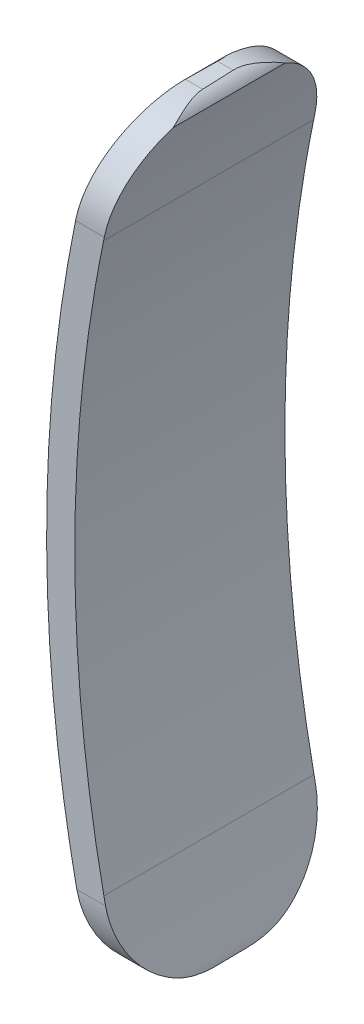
SolidWorks part; units mm, degrees
ref_plane "Front Plane" through (0, 0, 0) normal (0, 0, 1) x (1, 0, 0)
ref_plane "Top Plane" through (0, 0, 0) normal (0, 1, 0) x (1, 0, 0)
ref_plane "Right Plane" through (0, 0, 0) normal (1, 0, 0) x (0, 0, -1)
sketch "Sketch1" plane through (0, 0, 0) normal (0, 0, 1) x (1, 0, 0)
  arc A0 (-4.0644, 107.1781) -> (-0.2814, 105.8785) centre (-2.8226, 104.6368) cw
  arc A1 (-4, 0) -> (0, 0) centre (-2, 2) ccw
  ellipse E0 centre (191.9728, 53.8699) end of major axis (-11.2272, 53.8699) minor radius 203.1832 (-7.0515, 94.8489) -> (-7.0104, 12.6918) ccw
  spline S0 degree 3 poles (-7.0515, 94.8489) (-6.8815, 95.6746) (-6.7091, 96.4845) (-6.4476, 97.6768) (-6.36, 98.0705) (-6.1839, 98.85) (-6.0951, 99.2373) (-5.8335, 100.3632) (-5.6635, 101.0738) (-5.4171, 102.0805) (-5.3363, 102.4068) (-5.1785, 103.0364) (-5.1026, 103.3356) (-4.8841, 104.1886) (-4.7507, 104.6977) (-4.5716, 105.3701) (-4.5153, 105.5793) (-4.4127, 105.9574) (-4.3194, 106.2979) (-4.245, 106.5645) (-4.1804, 106.7937) (-4.153, 106.8898) (-4.0867, 107.118) (-4.0644, 107.1889) (-4.0644, 107.1781) knots 0 0 0 0 0.125 0.125 0.1875 0.1875 0.25 0.25 0.375 0.375 0.4375 0.4375 0.5 0.5 0.625 0.625 0.6875 0.6875 0.75 0.8125 0.8125 0.875 0.875 1 1 1 1
  spline S1 degree 3 poles (-4, 0) (-4, 0.0108) (-4.0229, 0.1047) (-4.0894, 0.3644) (-4.117, 0.4709) (-4.183, 0.7246) (-4.2215, 0.8721) (-4.3501, 1.3655) (-4.454, 1.7644) (-4.6346, 2.466) (-4.6994, 2.7187) (-4.8347, 3.251) (-4.9054, 3.5304) (-5.1252, 4.4073) (-5.2823, 5.0433) (-5.6153, 6.4214) (-5.7865, 7.1444) (-6.0471, 8.2727) (-6.1347, 8.6565) (-6.3111, 9.4398) (-6.4004, 9.8412) (-6.6655, 11.0503) (-6.8395, 11.8661) (-7.0104, 12.6918) knots 0 0 0 0 0.125 0.125 0.1875 0.1875 0.25 0.25 0.375 0.375 0.4375 0.4375 0.5 0.5 0.625 0.625 0.75 0.75 0.8125 0.8125 0.875 0.875 1 1 1 1
  spline S2 degree 3 poles (-0.2814, 105.8785) (-0.3009, 105.8117) (-0.3322, 105.7026) (-0.4494, 105.2861) (-0.6483, 104.5609) (-0.9701, 103.3501) (-1.4784, 101.3687) (-2.0763, 98.8983) (-2.6876, 96.1673) (-2.9886, 94.7467) (-3.1337, 94.0421) knots 0 0 0 0 0.055316 0.110633 0.221265 0.331898 0.44253 0.663795 0.774428 0.885061 0.885061 0.885061 0.885061
  spline S3 degree 3 poles (-3.1337, 94.0421) (-4.4963, 87.4256) (-6.549, 74.044) (-7.5713, 53.7701) (-6.5287, 33.4972) (-4.4626, 20.1176) (-3.0934, 13.5025) knots -0.203078 -0.203078 -0.203078 -0.203078 -0.101289 0.000501 0.10229 0.204079 0.204079 0.204079 0.204079
  spline S4 degree 3 poles (-3.0934, 13.5025) (-2.9275, 12.701) (-2.5823, 11.0819) (-2.0603, 8.7674) (-1.5539, 6.6297) (-1.0883, 4.7446) (-0.7522, 3.427) (-0.5305, 2.5706) (-0.3895, 2.0293) (-0.2931, 1.6598) (-0.2309, 1.4203) (-0.1914, 1.267) (-0.1636, 1.158) (-0.1438, 1.0788) (-0.1296, 1.0209) (-0.1149, 0.9593) (-0.1004, 0.8964) (-0.0837, 0.8182) (-0.0693, 0.7456) (-0.0527, 0.6503) (-0.0368, 0.548) (-0.0194, 0.4041) (-0.0052, 0.2314) (0, 0.071) (0, 0) knots 0 0 0 0 0.125 0.25 0.375 0.5 0.625 0.6875 0.75 0.8125 0.84375 0.875 0.90625 0.921875 0.9375 0.953125 0.96875 0.976562 0.984375 0.988281 0.992188 0.996094 0.998047 1 1 1 1
sketch "Sketch2" plane through (0, 0, 0) normal (0, 0, 1) x (1, 0, 0)
  arc A0 (-4.0644, 107.1781) -> (-0.2814, 105.8785) centre (-2.8226, 104.6368) cw
  arc A1 (-4, 0) -> (0, 0) centre (-2, 2) ccw
  ellipse E0 centre (191.9728, 53.8699) end of major axis (-11.2272, 53.8699) minor radius 203.1832 (-7.0515, 94.8489) -> (-7.0104, 12.6918) ccw
  spline S0 degree 3 poles (-7.0515, 94.8489) (-6.8815, 95.6746) (-6.7091, 96.4845) (-6.4476, 97.6768) (-6.36, 98.0705) (-6.1839, 98.85) (-6.0951, 99.2373) (-5.8335, 100.3632) (-5.6635, 101.0738) (-5.4171, 102.0805) (-5.3363, 102.4068) (-5.1785, 103.0364) (-5.1026, 103.3356) (-4.8841, 104.1886) (-4.7507, 104.6977) (-4.5716, 105.3701) (-4.5153, 105.5793) (-4.4127, 105.9574) (-4.3194, 106.2979) (-4.245, 106.5645) (-4.1804, 106.7937) (-4.153, 106.8898) (-4.0867, 107.118) (-4.0644, 107.1889) (-4.0644, 107.1781) knots 0 0 0 0 0.125 0.125 0.1875 0.1875 0.25 0.25 0.375 0.375 0.4375 0.4375 0.5 0.5 0.625 0.625 0.6875 0.6875 0.75 0.8125 0.8125 0.875 0.875 1 1 1 1
  spline S1 degree 3 poles (-4, 0) (-4, 0.0108) (-4.0229, 0.1047) (-4.0894, 0.3644) (-4.117, 0.4709) (-4.183, 0.7246) (-4.2215, 0.8721) (-4.3501, 1.3655) (-4.454, 1.7644) (-4.6346, 2.466) (-4.6994, 2.7187) (-4.8347, 3.251) (-4.9054, 3.5304) (-5.1252, 4.4073) (-5.2823, 5.0433) (-5.6153, 6.4214) (-5.7865, 7.1444) (-6.0471, 8.2727) (-6.1347, 8.6565) (-6.3111, 9.4398) (-6.4004, 9.8412) (-6.6655, 11.0503) (-6.8395, 11.8661) (-7.0104, 12.6918) knots 0 0 0 0 0.125 0.125 0.1875 0.1875 0.25 0.25 0.375 0.375 0.4375 0.4375 0.5 0.5 0.625 0.625 0.75 0.75 0.8125 0.8125 0.875 0.875 1 1 1 1
  spline S2 degree 3 poles (-0.2814, 105.8785) (-0.3009, 105.8117) (-0.3322, 105.7026) (-0.4494, 105.2861) (-0.6483, 104.5609) (-0.9701, 103.3501) (-1.4784, 101.3687) (-2.0763, 98.8983) (-2.6876, 96.1673) (-2.9886, 94.7467) (-3.1337, 94.0421) knots 0 0 0 0 0.055316 0.110633 0.221265 0.331898 0.44253 0.663795 0.774428 0.885061 0.885061 0.885061 0.885061
  spline S3 degree 3 poles (-3.1337, 94.0421) (-4.4963, 87.4256) (-6.549, 74.044) (-7.5713, 53.7701) (-6.5287, 33.4972) (-4.4626, 20.1176) (-3.0934, 13.5025) knots -0.203078 -0.203078 -0.203078 -0.203078 -0.101289 0.000501 0.10229 0.204079 0.204079 0.204079 0.204079
  spline S4 degree 3 poles (-3.0934, 13.5025) (-2.9275, 12.701) (-2.5823, 11.0819) (-2.0603, 8.7674) (-1.5539, 6.6297) (-1.0883, 4.7446) (-0.7522, 3.427) (-0.5305, 2.5706) (-0.3895, 2.0293) (-0.2931, 1.6598) (-0.2309, 1.4203) (-0.1914, 1.267) (-0.1636, 1.158) (-0.1438, 1.0788) (-0.1296, 1.0209) (-0.1149, 0.9593) (-0.1004, 0.8964) (-0.0837, 0.8182) (-0.0693, 0.7456) (-0.0527, 0.6503) (-0.0368, 0.548) (-0.0194, 0.4041) (-0.0052, 0.2314) (0, 0.071) (0, 0) knots 0 0 0 0 0.125 0.25 0.375 0.5 0.625 0.6875 0.75 0.8125 0.84375 0.875 0.90625 0.921875 0.9375 0.953125 0.96875 0.976562 0.984375 0.988281 0.992188 0.996094 0.998047 1 1 1 1
extrude "Boss-Extrude1" add sketch "Sketch2" along normal mid plane 50.8
sketch "Sketch4" plane through (0, 0, 0) normal (1, 0, 0) x (0, 0, -1)
  line L0 (-2.2223, 0) -> (2.2223, 0.0571)
  line L1 (14.7602, 12.7489) -> (14.7602, 94.9128)
  line L2 (1.9007, 107.242) -> (-2.5439, 107.1849)
  line L3 (-15.0823, 94.5292) -> (-15.0823, 12.3654)
  line L4 (-25.4, 0) -> (25.4, 0) construction
  line L6 (25.4, 12.6918) -> (25.4, 94.8489) construction
  line L7 (-25.4, 94.8489) -> (-25.4, 12.6918) construction
  line L9 (64.9395, 127.6358) -> (-59.58, 127.6358)
  line L10 (64.9395, 127.6358) -> (64.9395, -30.7766)
  line L11 (64.9395, -30.7766) -> (-59.58, -30.7766)
  line L12 (-59.58, 127.6358) -> (-59.58, -30.7766)
  spline S0 degree 3 poles (2.2223, 0.0571) (3.0658, 0.068) (3.8934, 0.1618) (5.1121, 0.4215) (5.5146, 0.528) (6.3117, 0.7817) (6.7062, 0.9292) (7.8516, 1.4226) (8.5742, 1.8215) (9.5978, 2.5232) (9.9305, 2.7759) (10.5647, 3.3081) (10.8665, 3.5875) (11.7275, 4.4645) (12.2427, 5.1004) (13.1521, 6.4785) (13.5333, 7.2016) (13.9954, 8.3298) (14.1312, 8.7136) (14.3654, 9.4969) (14.464, 9.8983) (14.697, 11.1075) (14.7709, 11.9232) (14.7602, 12.7489) knots 0 0 0 0 0.125 0.125 0.1875 0.1875 0.25 0.25 0.375 0.375 0.4375 0.4375 0.5 0.5 0.625 0.625 0.75 0.75 0.8125 0.8125 0.875 0.875 1 1 1 1
  spline S1 degree 3 poles (14.7602, 94.9128) (14.7496, 95.7385) (14.6572, 96.5484) (14.4014, 97.7407) (14.2964, 98.1344) (14.0464, 98.9139) (13.9004, 99.3012) (13.4109, 100.4271) (13.0143, 101.1377) (12.3148, 102.1444) (12.0636, 102.4707) (11.5268, 103.1003) (11.2447, 103.3996) (10.3585, 104.2525) (9.7149, 104.7616) (8.6683, 105.434) (8.3046, 105.6432) (7.5657, 106.0213) (6.8117, 106.3618) (6.0277, 106.6285) (5.2285, 106.8576) (4.82, 106.9537) (3.5792, 107.1819) (2.744, 107.2528) (1.9007, 107.242) knots 0 0 0 0 0.125 0.125 0.1875 0.1875 0.25 0.25 0.375 0.375 0.4375 0.4375 0.5 0.5 0.625 0.625 0.6875 0.6875 0.75 0.8125 0.8125 0.875 0.875 1 1 1 1
  spline S2 degree 3 poles (-2.5439, 107.1849) (-3.387, 107.174) (-4.2147, 107.0818) (-5.434, 106.8266) (-5.8367, 106.7219) (-6.6345, 106.4723) (-7.0299, 106.3269) (-8.1785, 105.8402) (-8.9034, 105.446) (-9.9301, 104.751) (-10.2638, 104.5005) (-10.9013, 103.9708) (-11.2044, 103.6925) (-12.0682, 102.8184) (-12.5839, 102.1837) (-13.2648, 101.1512) (-13.4742, 100.7962) (-13.8541, 100.0734) (-14.1965, 99.3353) (-14.4651, 98.5667) (-14.696, 97.7827) (-14.7929, 97.3811) (-15.0214, 96.1709) (-15.0929, 95.3548) (-15.0823, 94.5292) knots 0 0 0 0 0.125 0.125 0.1875 0.1875 0.25 0.25 0.375 0.375 0.4375 0.4375 0.5 0.5 0.625 0.625 0.6875 0.6875 0.75 0.8125 0.8125 0.875 0.875 1 1 1 1
  spline S3 degree 3 poles (-15.0823, 12.3654) (-15.0717, 11.5393) (-14.9768, 10.7296) (-14.7165, 9.5382) (-14.6099, 9.1448) (-14.3565, 8.366) (-14.209, 7.9793) (-13.7155, 6.855) (-13.3169, 6.1449) (-12.6162, 5.1378) (-12.3646, 4.8109) (-11.8289, 4.1811) (-11.5476, 3.8813) (-10.6643, 3.0258) (-10.0233, 2.5136) (-8.9805, 1.8352) (-8.6181, 1.6239) (-7.8816, 1.2413) (-7.5057, 1.0688) (-6.3552, 0.6069) (-5.5566, 0.3724) (-3.9016, 0.0617) (-3.066, -0.0108) (-2.2223, 0) knots 0 0 0 0 0.125 0.125 0.1875 0.1875 0.25 0.25 0.375 0.375 0.4375 0.4375 0.5 0.5 0.625 0.625 0.6875 0.6875 0.75 0.75 0.875 0.875 1 1 1 1
  point P8 (-2.2223, 0)
  dimension "D1" = 4.4446
  dimension "D2" = 2.2223
extrude "Cut-Extrude1" cut sketch "Sketch4" against normal through all
